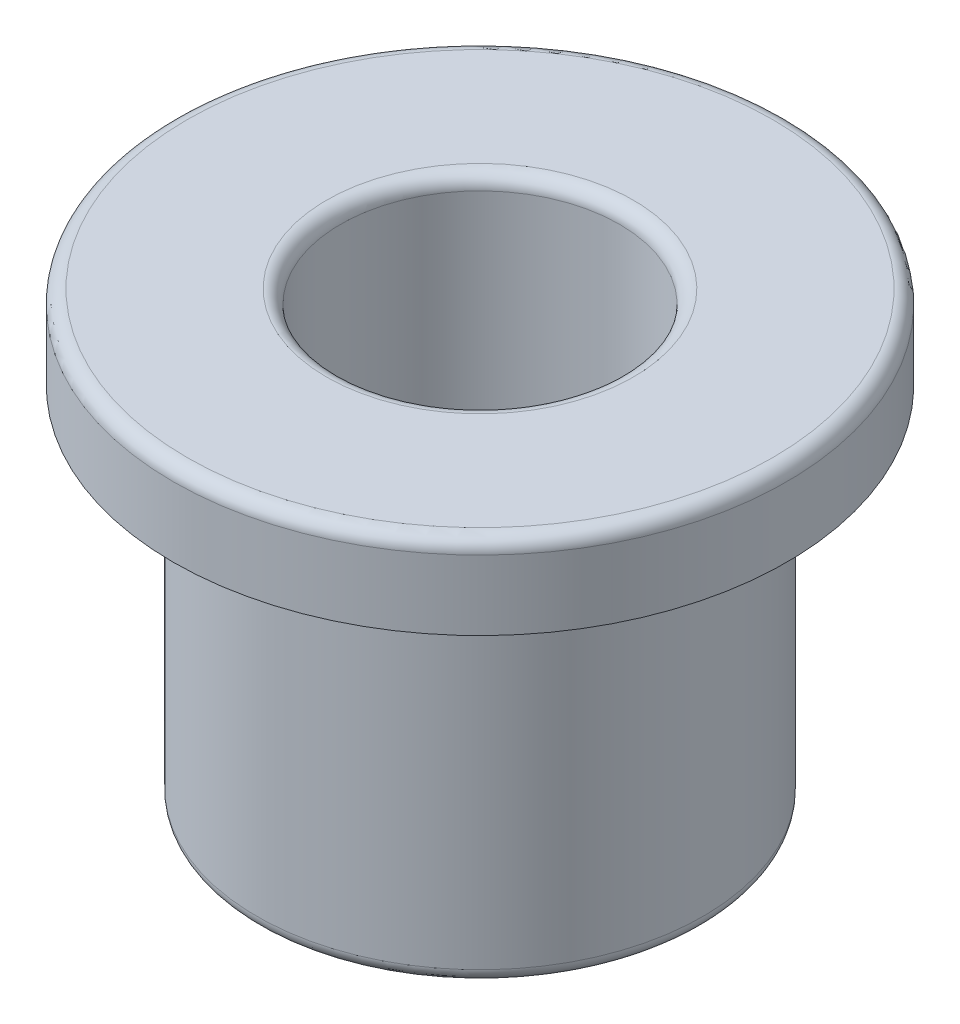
SolidWorks part; units mm, degrees
ref_plane "Face" through (0, 0, 0) normal (0, 0, 1) x (1, 0, 0)
ref_plane "Dessus" through (0, 0, 0) normal (0, 1, 0) x (1, 0, 0)
ref_plane "Droite" through (0, 0, 0) normal (1, 0, 0) x (0, 0, -1)
sketch "Esquisse1" plane through (0, 0, 0) normal (0, 0, 1) x (1, 0, 0)
  line L0 (0, 0) -> (0, 16.9468) construction
  line L1 (5, 0) -> (8, 0)
  line L2 (5, 0) -> (5, 16)
  line L4 (8, 0) -> (8, 13)
  line L5 (8, 13) -> (11, 13)
  line L7 (5, 16) -> (11, 16)
  line L8 (11, 13) -> (11, 16)
  dimension "D1" = 5
  dimension "D2" = 8
  dimension "D3" = 16
  dimension "D4" = 11
  dimension "D5" = 3
revolve "Révolution1" add sketch "Esquisse1" angle 360 about L0
fillet "Congé1" radius 0.5 5 edges at (0, 0, -5) (0, 0, -8) (0, 13, -8) (0, 16, -11) (0, 16, -5)
